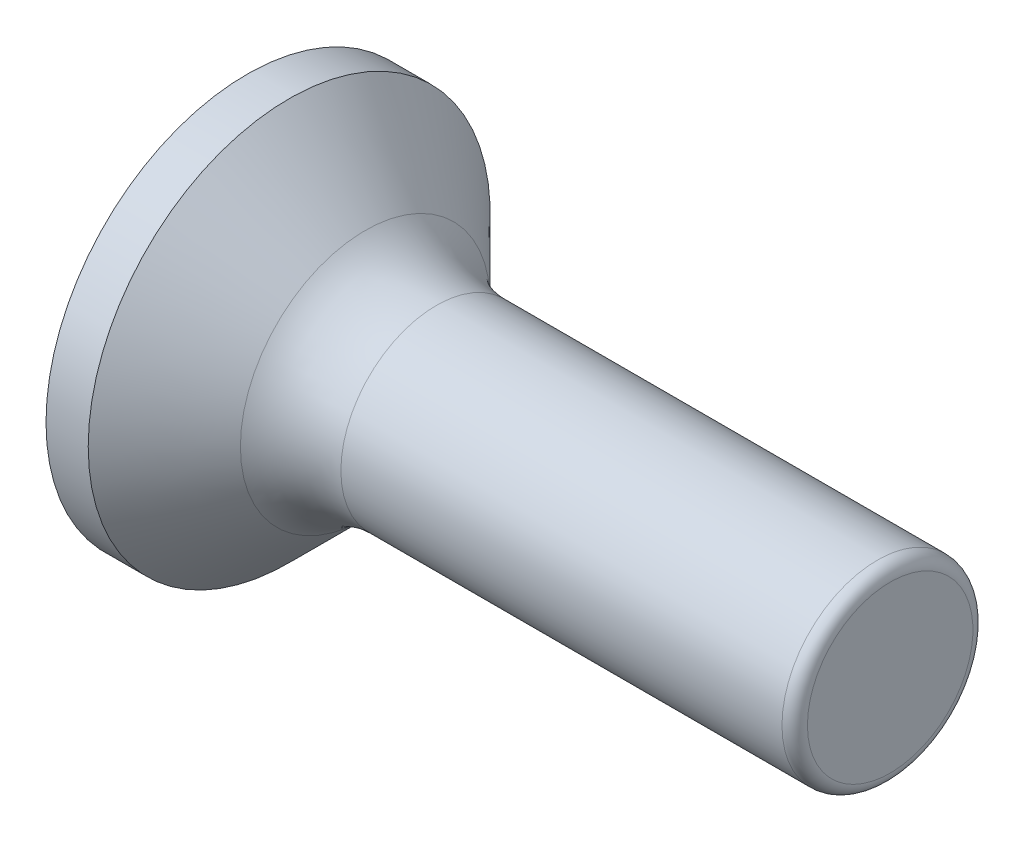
SolidWorks part; units mm, degrees
ref_plane "Front" through (0, 0, 0) normal (0, 0, 1) x (1, 0, 0)
ref_plane "Top" through (0, 0, 0) normal (0, 1, 0) x (1, 0, 0)
ref_plane "Right" through (0, 0, 0) normal (1, 0, 0) x (0, 0, -1)
sketch "Sketch1" plane through (0, 0, 0) normal (0, 0, 1) x (1, 0, 0)
  line L0 (-11.6961, 0) -> (11.3165, 0) construction
  line L1 (32, 0) -> (32, 4.75)
  line L2 (32, 4.75) -> (9.4211, 4.75)
  line L4 (2.1, 10) -> (0, 10)
  line L5 (32, 0) -> (0, 0)
  line L6 (5.8855, 6.2145) -> (2.1, 10)
  line L7 (0, 10) -> (0, 0)
  arc A0 (5.8855, 6.2145) -> (9.4211, 4.75) centre (9.4211, 9.75) ccw
  dimension "r" = 5
  dimension "D1" = 45
  dimension "st" = 9.5
  dimension "k" = 5.8855
  dimension "l" = 32
  dimension "dk" = 20
  dimension "a" = 5.4309
revolve "Base" add sketch "Sketch1" angle 360 about L0
sketch "Sketch2" plane through (0, 0, 0) normal (1, 0, 0) x (0, 0, -1)
  line L0 (-6.8682, 0) -> (7.6314, 0) construction
  line L1 (0, 6.2457) -> (0, -5.6834) construction
  line L2 (1, 5) -> (-1, 5)
  line L3 (-1, 5) -> (-1, 1)
  line L4 (-1, 1) -> (-5, 1)
  line L5 (-5, 1) -> (-5, -1)
  line L6 (-1, -1) -> (-5, -1)
  line L7 (-1, -5) -> (-1, -1)
  line L8 (1, -5) -> (-1, -5)
  line L9 (1, -5) -> (1, -1)
  line L10 (1, -1) -> (5, -1)
  line L11 (5, 1) -> (5, -1)
  line L12 (1, 1) -> (5, 1)
  line L13 (1, 5) -> (1, 1)
  point P5 (5, 0)
  point P11 (-5, 0)
  point P15 (0, -5)
  point P20 (0, 5)
  dimension "D1" = 2
  dimension "m" = 10
extrude "Cut-Extrude1" cut sketch "Sketch2" along normal blind 2.9428
draft "Draft1" type of draft neutral plane draft angle 30 faces to draft 4 parameters "D1"=30
fillet "Fillet1" radius 0.6333 1 edges at (32, 0, 4.75)
sketch "Sketch3" plane through (0, 0, 0) normal (0, 0, 1) x (1, 0, 0)
  line L0 (10.8415, 5.7) -> (11.7915, 5.7)
  line L1 (11.7915, 5.7) -> (11.7915, 4.75)
  line L2 (11.7915, 4.75) -> (11.3165, 3.9273)
  line L3 (11.3165, 3.9273) -> (10.8415, 4.75)
  line L4 (10.8415, 4.75) -> (10.8415, 5.7)
  line L5 (0, 0) -> (8.0438, 0) construction
  line L6 (5.8855, 6.2145) -> (5.8855, -6.2145) construction
  dimension "D1" = 9.5
  dimension "D2" = 0.95
  dimension "D3" = 5.4309
revolve "Cut-Revolve10" [suppressed] cut sketch "Sketch3" angle 360 about L5
pattern_linear "LPattern10" [suppressed] count 18 spacing 1.14 along (1, 0, 0)
equation "\"D2@ThreadCosmetic1\" = \"st@Sketch1\" * 4 / 5"
equation "\"D1@Sketch2\" = \"m@Sketch2\" / 5"
equation "\"qs@Cut-Extrude1\" = \"k@Sketch1\" / 2"
equation "\"D1@ThreadCosmetic1\" = \"l@Sketch1\" - \"k@Sketch1\"  - \"a@Sketch1\""
equation "\"D1@Fillet1\" = \"st@Sketch1\" / 15"
equation "\"D1@Sketch3\" = \"st@Sketch1\""
equation "\"D2@Sketch3\" = (  \"st@Sketch1\" - \"D2@ThreadCosmetic1\" )  / 2"
equation "\"D3@Sketch3\" = \"a@Sketch1\""
equation "\"D3@LPattern10\" = \"D2@Sketch3\" * 1.2"
equation "\"D1@LPattern10\" = \"D1@ThreadCosmetic1\" / \"D3@LPattern10\""
